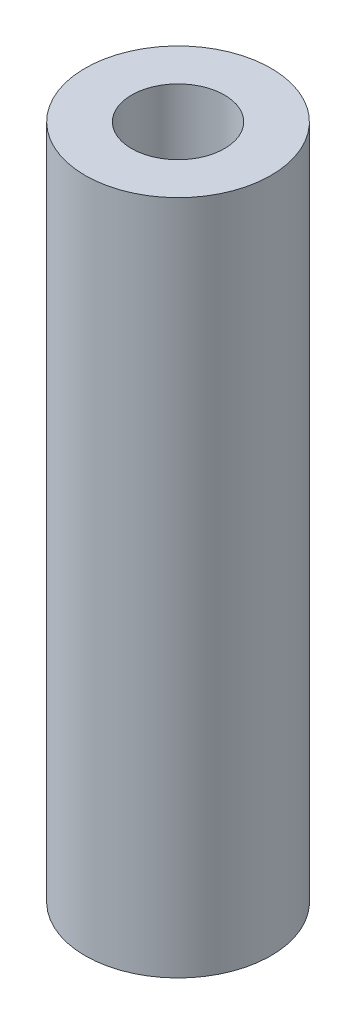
SolidWorks part; units mm, degrees
ref_plane "Front Plane" through (0, 0, 0) normal (0, 0, 1) x (1, 0, 0)
ref_plane "Top Plane" through (0, 0, 0) normal (0, 1, 0) x (1, 0, 0)
ref_plane "Right Plane" through (0, 0, 0) normal (1, 0, 0) x (0, 0, -1)
sketch "Sketch1" plane through (0, 0, 0) normal (0, 1, 0) x (1, 0, 0)
  circle A0 centre (0, 0) radius 5.5
  circle A1 centre (0, 0) radius 11
  dimension "D1" = 22
  dimension "D2" = 11
extrude "Boss-Extrude1" add sketch "Sketch1" along normal blind 80
